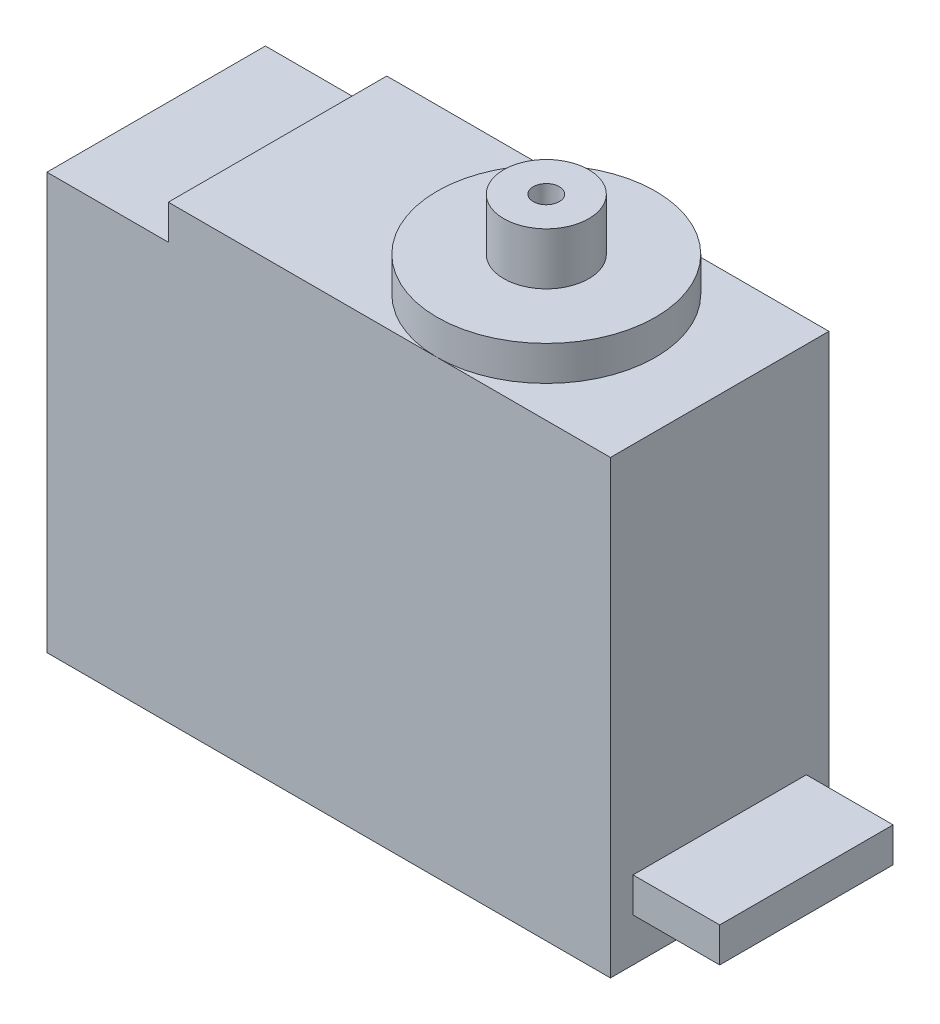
SolidWorks part; units mm, degrees
ref_plane "Front Plane" through (0, 0, 0) normal (0, 0, 1) x (1, 0, 0)
ref_plane "Top Plane" through (0, 0, 0) normal (0, 1, 0) x (1, 0, 0)
ref_plane "Right Plane" through (0, 0, 0) normal (1, 0, 0) x (0, 0, -1)
sketch "Sketch1" plane through (0, 0, 0) normal (0, 1, 0) x (1, 0, 0)
  line L1 (0, 0) -> (-32.5, 0)
  line L2 (0, 0) -> (0, 12.6)
  line L3 (0, 12.6) -> (-32.5, 12.6)
  line L4 (-32.5, 0) -> (-32.5, 12.6)
  dimension "D1" = 32.5
  dimension "D2" = 12.6
extrude "Boss-Extrude1" add sketch "Sketch1" along normal blind 24
sketch "Sketch2" plane through (0, 24, 0) normal (0, 1, 0) x (1, 0, 0)
  line L0 (0, 12.6) -> (-32.5, 12.6) construction
  line L1 (-25.5, 12.6) -> (0, 12.6)
  line L2 (-25.5, 12.6) -> (-25.5, 0)
  line L3 (-25.5, 0) -> (0, 0)
  line L4 (0, 12.6) -> (0, 0)
  dimension "D1" = 7
extrude "Boss-Extrude2" add sketch "Sketch2" along normal blind 2
sketch "Sketch3" plane through (0, 26, 0) normal (0, 1, 0) x (1, 0, 0)
  line L0 (0, 0) -> (0, 12.6) construction
  line L1 (0, 12.6) -> (-25.5, 12.6) construction
  circle A0 centre (-10, 6.3) radius 6.3
  point P4 (0, 6.3)
  dimension "D1" = 10
extrude "Boss-Extrude3" add sketch "Sketch3" along normal blind 2
sketch "Sketch4" plane through (0, 28, 0) normal (0, 1, 0) x (1, 0, 0)
  circle A0 centre (-10, 6.3) radius 2.45
  arc A1 (-10, 12.6) -> (-10, 0) centre (-10, 6.3) ccw construction
  dimension "D1" = 4.9
extrude "Boss-Extrude4" add sketch "Sketch4" along normal blind 3
sketch "Sketch5" plane through (0, 31, 0) normal (0, 1, 0) x (1, 0, 0)
  circle A0 centre (-10, 6.3) radius 0.75
  circle A1 centre (-10, 6.3) radius 2.45 construction
  dimension "D1" = 1.5
extrude "Cut-Extrude1" cut sketch "Sketch5" against normal blind 3
sketch "Sketch6" plane through (0, 0, 0) normal (1, 0, 0) x (0, 0, -1)
  line L1 (1.3, 2.5) -> (11.3, 2.5)
  line L2 (1.3, 2.5) -> (1.3, 4.5)
  line L3 (1.3, 4.5) -> (11.3, 4.5)
  line L4 (11.3, 2.5) -> (11.3, 4.5)
  line L6 (0, 0) -> (12.6, 0) construction
  point P6 (6.3, 0)
  point P7 (6.3, 2.5)
  dimension "D1" = 2.5
  dimension "D2" = 2
  dimension "D3" = 10
extrude "Boss-Extrude5" add sketch "Sketch6" along normal blind 5
